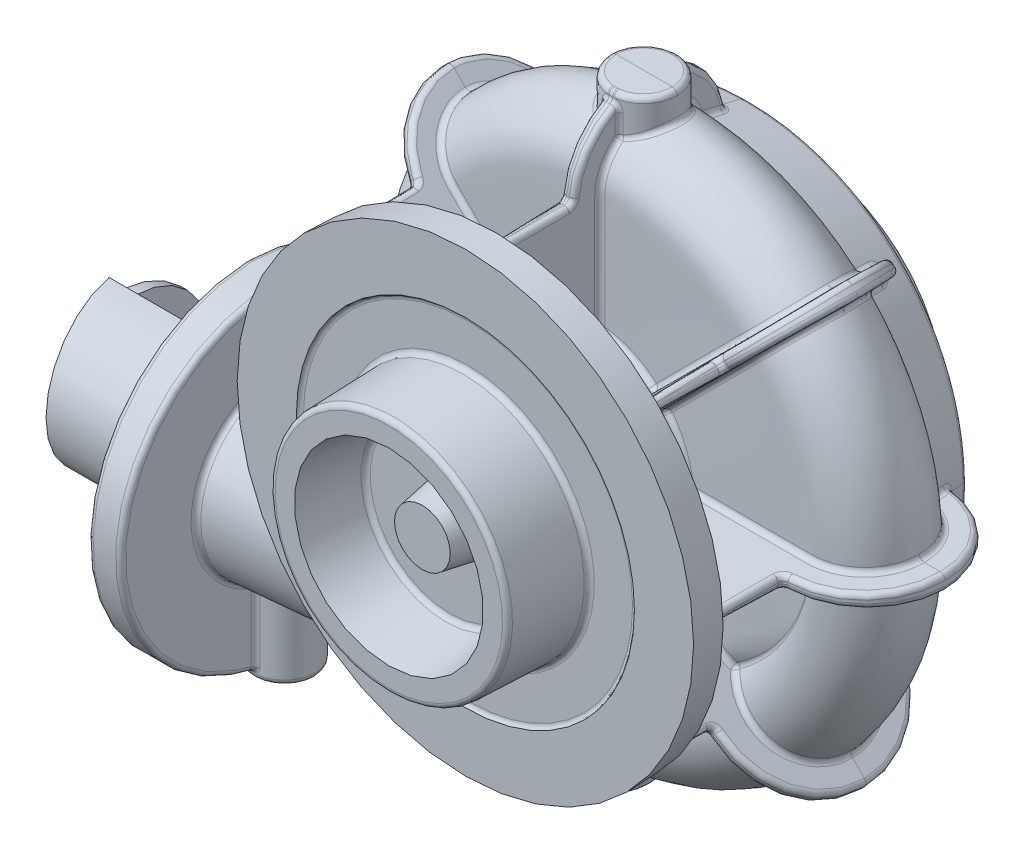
SolidWorks part; units mm, degrees
ref_plane "Plan de face" through (0, 0, 0) normal (0, 0, 1) x (1, 0, 0)
ref_plane "Plan de dessus" through (0, 0, 0) normal (0, 1, 0) x (1, 0, 0)
ref_plane "Plan de droite" through (0, 0, 0) normal (1, 0, 0) x (0, 0, -1)
ref_plane "Plan1" through (-220, 0, 0) normal (-1, 0, 0) x (0, 0, 1)
sketch "Esquisse3" plane through (-220, 0, 0) normal (-1, 0, 0) x (0, 0, 1)
  line L1 (-75, -160) -> (120, -160)
  line L2 (-75, -160) -> (-75, 125)
  line L3 (-75, 125) -> (120, 125)
  line L4 (120, -160) -> (120, 125)
  dimension "D1" = 125
  dimension "D2" = 160
  dimension "D3" = 75
  dimension "D4" = 120
extrude "Extrusion1" add sketch "Esquisse3" against normal blind 350
other "Empreinte1"
other "NEGATIF DU<1>@E D M1"
other "NEGATIF MILIEU<1>@E D M1"
other "NEGATIF DO<1>@E D M1"
other "NOYAU<1>@E D M1"
